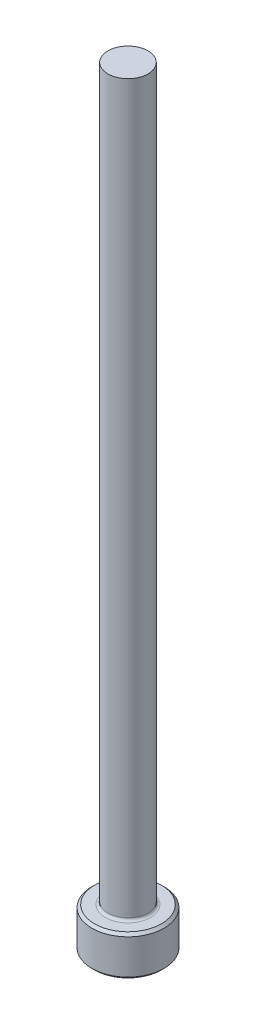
SolidWorks part; units mm, degrees
ref_plane "Front Plane" through (0, 0, 0) normal (0, 0, 1) x (1, 0, 0)
ref_plane "Top Plane" through (0, 0, 0) normal (0, 1, 0) x (1, 0, 0)
ref_plane "Right Plane" through (0, 0, 0) normal (1, 0, 0) x (0, 0, -1)
sketch "Sketch1" plane through (0, 0, 0) normal (0, 0, 1) x (1, 0, 0)
  line L0 (0, 259.9588) -> (0, -15.1925) construction
  line L1 (0, 0) -> (-3.5687, 0)
  line L2 (-3.5687, 0) -> (-3.5687, 3.9624)
  line L3 (-3.5687, 3.9624) -> (-1.9837, 3.9624)
  line L4 (-1.9837, 3.9624) -> (-1.9837, 76.2)
  line L5 (-1.9837, 76.2) -> (0, 76.2)
  line L6 (0, 76.2) -> (0, 0)
  dimension "L" = 76.2
  dimension "H" = 7.1374
  dimension "T" = 3.9624
  dimension "D" = 3.9675
revolve "Revolve1" add sketch "Sketch1" angle 360 about L0
chamfer "Chamfer1" distance 0.254 angle 45 2 edges at (0, 3.9624, 3.5687) (0, 0, 3.5687)
fillet "Fillet1" radius 0.254 1 edges at (0, 3.9624, 1.9837)
sketch "Pocket Sketch" plane through (0, 0, 0) normal (0, 0, 1) x (1, 0, 0)
  line L0 (-3.9656, 0) -> (-3.9656, 3.9878)
  line L1 (-3.9656, 3.9878) -> (-2.9442, 3.9878)
  line L2 (-2.1822, 4.7498) -> (-2.1822, 22.225)
  line L3 (-2.1822, 22.225) -> (0, 22.225)
  line L4 (0, 22.225) -> (0, 0)
  line L5 (0, 0) -> (-3.9656, 0)
  line L6 (0, 12.6104) -> (0, -2.4989) construction
  line L7 (-3.5687, 3.7084) -> (-3.5687, 0.254) construction
  line L8 (3.3147, 3.9624) -> (-3.3147, 3.9624) construction
  line L9 (-1.9837, 76.2) -> (-1.9837, 4.2164) construction
  line L10 (-2.9442, 3.9878) -> (-2.1822, 4.7498)
  point P3 (-2.1822, 3.9878)
  dimension "D1" = 7.9311
  dimension "D2" = 0.3969
  dimension "D3" = 0.0254
  dimension "D4" = 0.1984
  dimension "D5" = 4.3644
  dimension "D6" = 22.225
